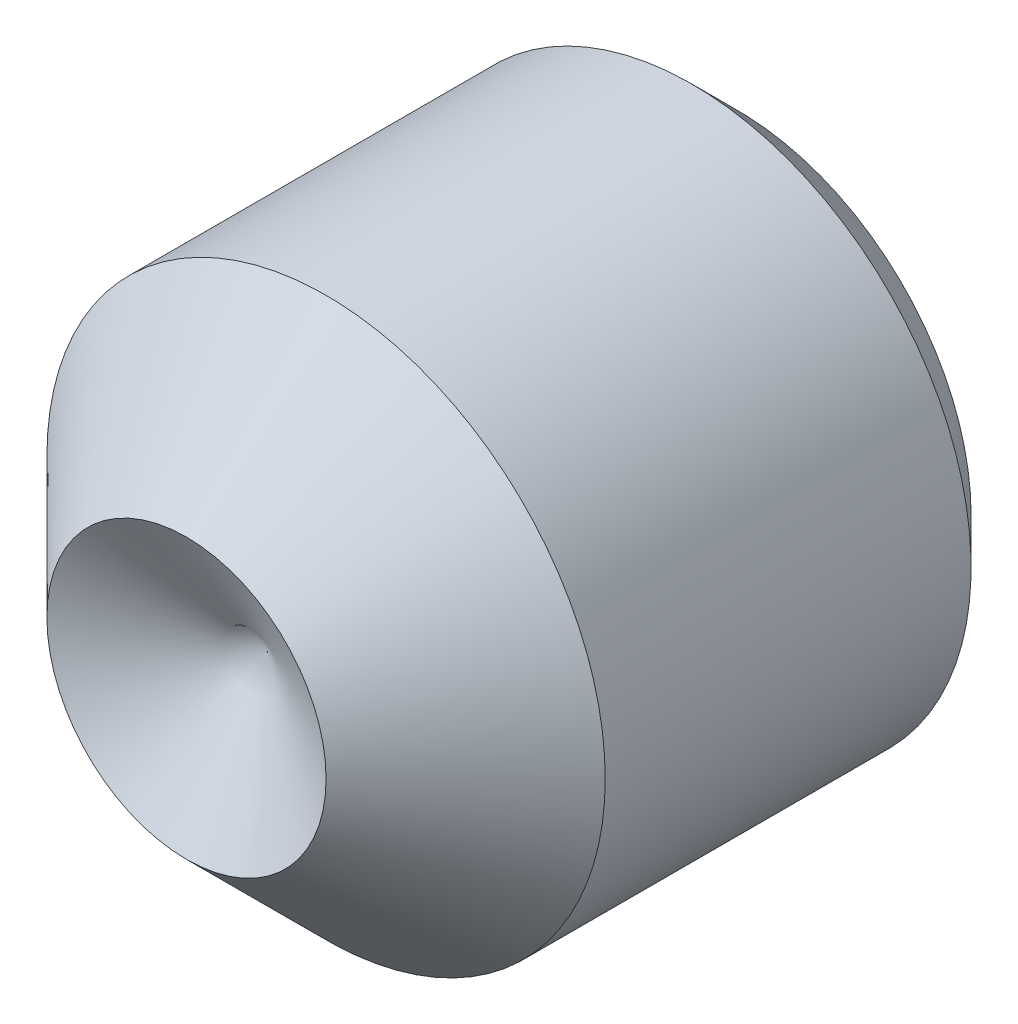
SolidWorks part; units mm, degrees
ref_plane "Front" through (0, 0, 0) normal (0, 0, 1) x (1, 0, 0)
ref_plane "Top" through (0, 0, 0) normal (0, 1, 0) x (1, 0, 0)
ref_plane "Right" through (0, 0, 0) normal (1, 0, 0) x (0, 0, -1)
sketch "Logo3_Revol_Axis" plane through (0, 0, 0) normal (0, 1, 0) x (1, 0, 0)
  line L0 (0, -43.5172) -> (0, 43.5172) construction
sketch "Logo3_bib1" plane through (0, 0, 0) normal (0, -1, 0) x (-1, 0, 0)
  line L0 (0, -4.7625) -> (0, 0)
  line L1 (0, -4.7625) -> (5, -4.7625) construction
  line L2 (0.7874, 0) -> (0.7874, -4.7625) construction
  line L3 (0, 0) -> (2.0193, 0)
  line L4 (2.413, -0.3937) -> (2.413, -4.3688)
  line L5 (0.7874, 0) -> (0, -0.7874) construction
  line L6 (0.3937, -0.3937) -> (2.413, -0.3937) construction
  line L7 (2.413, -0.3937) -> (2.0193, 0) construction
  line L8 (2.0193, 0) -> (2.413, -0.3937)
  line L9 (2.0193, 0) -> (2.0193, -4.7625) construction
  line L10 (0, 10.5852) -> (0, -63.2873) construction
  line L11 (2.0193, -4.7625) -> (2.413, -4.3688) construction
  line L12 (2.0193, -4.7625) -> (0, -4.7625)
  line L13 (2.413, -4.3688) -> (2.0193, -4.7625)
revolve "Revolve1" add sketch "Logo3_bib1" angle 360 about L10
sketch "Logo3_bib11" plane through (0, 0, 0) normal (0, 0, -1) x (1, 0, 0)
  line L1 (1.3741, 0) -> (0.687, 1.19)
  line L2 (0.687, 1.19) -> (-0.687, 1.19)
  line L3 (-0.687, 1.19) -> (-1.3741, 0)
  line L4 (-1.3741, 0) -> (-0.687, -1.19)
  line L5 (-0.687, -1.19) -> (0.687, -1.19)
  line L6 (0.687, -1.19) -> (1.3741, 0)
  circle A0 centre (0, 0) radius 1.19 construction
  dimension "Logo3_key" = 2.38
extrude "Cut-Extrude1" cut sketch "Logo3_bib11" against normal blind 2.5
sketch "Logo3_bib2" [suppressed] plane through (0, 0, 0) normal (0, 1, 0) x (1, 0, 0)
  line L0 (-3.1431, -30) -> (-3.1431, 0) construction
  line L1 (-4, -30) -> (0, -30) construction
  line L2 (0, 0) -> (-4, 0) construction
  line L3 (0, -43.5172) -> (0, 43.5172) construction
  line L4 (-5, -29) -> (0, -29) construction
  line L5 (-3.1431, -29) -> (-0.7675, -30)
  line L6 (0, -26.2867) -> (-4, -26.2867) construction
  line L11 (-4, 0) -> (-4, -30) construction
  line L12 (-4, -26.2867) -> (-5, -24.6806) construction
  line L13 (-5, -1) -> (-5, -29) construction
  line L15 (-5, -24.6806) -> (-7, -24.6806)
  line L16 (-7, -24.6806) -> (-7, -32.5)
  line L17 (-7, -32.5) -> (-0.7675, -32.5)
  line L18 (-5, -24.6806) -> (-4, -26.2867)
  line L19 (-4, -26.2867) -> (-3.1431, -26.2867)
  line L20 (-3.1431, -26.2867) -> (-3.1431, -29)
  line L21 (-0.7675, -30) -> (-0.7675, -32.5)
  line L22 (0, 0) -> (0, -32.5) construction
  dimension "D1" = 22.828
  dimension "D2" = 58.093
  dimension "D3" = 2
  dimension "logo3_d2" = 12
  dimension "logo3_l2" = 3.7133
  dimension "D4" = 2.5
revolve "Type2" [suppressed] cut sketch "Logo3_bib2" angle 360 about L0
sketch "Logo3_bib3" plane through (0, 0, 0) normal (0, 1, 0) x (1, 0, 0)
  line L0 (0, 0) -> (0, -4.7625) construction
  line L1 (0, -4.7625) -> (-5, -4.7625) construction
  line L2 (1.2065, -4.7625) -> (1.2065, -5.7625) construction
  line L4 (-1.2065, -4.7625) -> (-2.413, -3.556)
  line L5 (-2.413, -0.3937) -> (-2.413, -4.3688) construction
  line L6 (-2.413, -3.556) -> (-3.413, -3.556)
  line L7 (-3.413, -3.556) -> (-3.413, -5.7625)
  line L8 (-3.413, -5.7625) -> (0, -5.7625)
  line L9 (0, 10.5852) -> (0, -63.2873) construction
  line L10 (-1.2065, -4.7625) -> (0, -4.0659)
  line L12 (0, -4.0659) -> (0, -5.7625)
  line L13 (-1.2065, -4.7625) -> (-1.2065, -5.7625) construction
  dimension "D1" = 30
  dimension "logo3_d2" = 2.413
  dimension "D2" = 45
  dimension "D3" = 1
  dimension "D4" = 1
revolve "Type3" cut sketch "Logo3_bib3" angle 360 about L0
sketch "Logo3_bib4" [suppressed] plane through (0, 0, 0) normal (0, 1, 0) x (1, 0, 0)
  line L0 (0, 0) -> (0, -30) construction
  line L1 (-2.9915, 0) -> (-2.9915, -30) construction
  line L2 (0, 0) -> (-4, 0) construction
  line L3 (-4, -30) -> (0, -30) construction
  line L4 (-2.9915, -30) -> (-5, -27.8033)
  line L5 (-5, -1) -> (-5, -29) construction
  line L6 (-5, -27.8033) -> (-7.5117, -27.8033)
  line L7 (-7.5117, -27.8033) -> (-7.5117, -34.0728)
  line L8 (-7.5117, -34.0728) -> (-2.9915, -34.0728)
  line L9 (-2.9915, -34.0728) -> (-2.9915, -30)
  dimension "D1" = 47.562
  dimension "logo3_d2" = 12
  dimension "D2" = 2.5117
  dimension "D3" = 4.0728
revolve "Type4" [suppressed] cut sketch "Logo3_bib4" angle 360 about L0
equation "\"D2@Cosmetic Thread1\" = \"logo3_d1@Logo3_bib1\"-\"logo3_pas@Logo3_bib1\""
